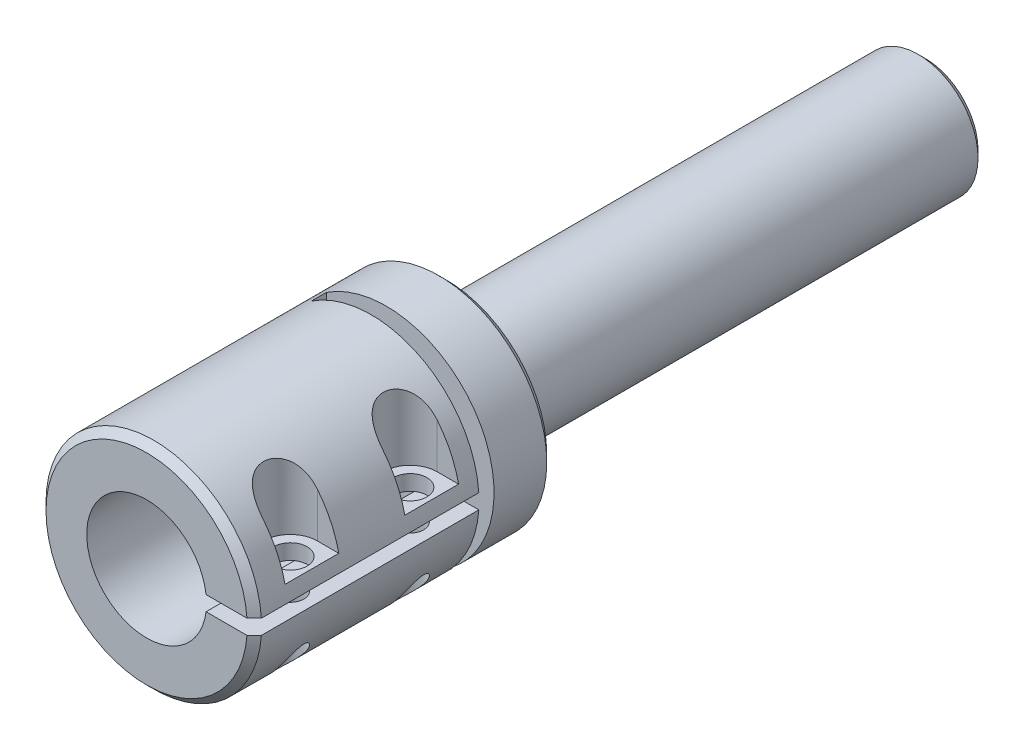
SolidWorks part; units mm, degrees
ref_plane "Front Plane" through (0, 0, 0) normal (0, 0, 1) x (1, 0, 0)
ref_plane "Top Plane" through (0, 0, 0) normal (0, 1, 0) x (1, 0, 0)
ref_plane "Right Plane" through (0, 0, 0) normal (1, 0, 0) x (0, 0, -1)
sketch "Sketch1" plane through (0, 0, 0) normal (0, 0, 1) x (1, 0, 0)
  circle A0 centre (0, 0) radius 11.43
  dimension "D1" = 22.86
extrude "Boss-Extrude1" add sketch "Sketch1" along normal blind 31.75
sketch "Sketch2" plane through (0, 0, 31.75) normal (0, 0, 1) x (1, 0, 0)
  circle A0 centre (0, 0) radius 6.35
  dimension "D1" = 12.7
extrude "Cut-Extrude1" cut sketch "Sketch2" against normal blind 25.4
sketch "Sketch3" plane through (0, 0, 0) normal (0, 0, -1) x (-1, 0, 0)
  circle A0 centre (0, 0) radius 6.35
  dimension "D1" = 12.7
extrude "Boss-Extrude2" add sketch "Sketch3" along normal blind 50.8
chamfer "Chamfer1" distance 0.762 angle 45 1 edges at (-6.35, 0, -50.8)
ref_plane "Plane1" through (0, 2.413, 0) normal (0, 1, 0) x (-1, 0, 0)
sketch "Sketch4" plane through (0, 2.413, 0) normal (0, 1, 0) x (-1, 0, 0)
  line L0 (-11.43, 25.4) -> (-6.35, 25.4) construction
  line L1 (-11.43, 31.75) -> (-11.43, 0) construction
  line L2 (-6.35, 31.75) -> (-6.35, 6.35) construction
  line L3 (-11.43, 12.7) -> (-6.35, 12.7) construction
  line L5 (11.43, 31.75) -> (-11.43, 31.75) construction
  circle A0 centre (-8.89, 25.4) radius 1.778
  circle A1 centre (-8.89, 12.7) radius 1.778
  dimension "D1" = 3.556
  dimension "D2" = 6.35
  dimension "D3" = 12.7
extrude "Cut-Extrude2" cut sketch "Sketch4" against normal blind 3.175
sketch "Sketch5" plane through (0, 0, 31.75) normal (0, 0, 1) x (1, 0, 0)
  line L1 (0, 0.7874) -> (31.0854, 0.7874)
  line L2 (0, 0.7874) -> (0, -0.7874)
  line L3 (0, -0.7874) -> (31.0854, -0.7874)
  line L4 (31.0854, 0.7874) -> (31.0854, -0.7874)
  dimension "D1" = 1.5748
extrude "Cut-Extrude3" cut sketch "Sketch5" against normal up to surface (25.4 mm away)
sketch "Sketch6" plane through (0, 2.413, 0) normal (0, 1, 0) x (-1, 0, 0)
  line L0 (-8.89, 28.25) -> (-11.4028, 28.25)
  line L1 (-11.4028, 31.75) -> (-11.4028, 6.35) construction
  line L2 (-11.4028, 28.25) -> (-11.4028, 22.55)
  line L3 (-11.4028, 22.55) -> (-8.89, 22.55)
  line L4 (-8.89, 15.55) -> (-11.4028, 15.55)
  line L5 (-11.4028, 15.55) -> (-11.4028, 9.85)
  line L6 (-11.4028, 9.85) -> (-8.89, 9.85)
  arc A0 (-8.89, 22.55) -> (-8.89, 28.25) centre (-8.89, 25.4) ccw
  arc A1 (-8.89, 9.85) -> (-8.89, 15.55) centre (-8.89, 12.7) ccw
  dimension "D1" = 5.7
extrude "Cut-Extrude4" cut sketch "Sketch6" along normal through all
ref_plane "Plane2" through (-6.35, 0, 0) normal (1, 0, 0) x (0, 0, -1)
sketch "Sketch7" plane through (-6.35, 0, 0) normal (1, 0, 0) x (0, 0, -1)
  line L0 (-6.35, 0.7874) -> (-6.35, -0.7874) construction
  line L1 (-7.9375, 26.5989) -> (-6.35, 26.5989)
  line L2 (-7.9375, 26.5989) -> (-7.9375, -24.7744)
  line L3 (-7.9375, -24.7744) -> (-6.35, -24.7744)
  line L4 (-6.35, 26.5989) -> (-6.35, -24.7744)
  dimension "D1" = 1.5875
extrude "Cut-Extrude5" cut sketch "Sketch7" along normal through all
sketch "Sketch8" plane through (0, 0, 0) normal (0, 0, -1) x (-1, 0, 0)
  circle A0 centre (0, 0) radius 6.35
  circle A1 centre (0, 0) radius 6.0325
  circle A2 centre (0, 0) radius 6.35 construction
  dimension "D1" = 12.065
extrude "Cut-Extrude6" cut sketch "Sketch8" along normal blind 0.381
chamfer "Chamfer2" distance 0.762 angle 45 2 edges at (-11.43, 0, 31.75) (11.43, 0, 0)
hole_wizard "#6-40 Tapped Hole1" positions "Sketch10" profile "Sketch9" tap size "#6-40" standard "ANSI Inch"
sketch "Sketch10" plane through (0, -0.7874, 0) normal (0, 1, 0) x (1, 0, 0)
  circle A1 centre (8.89, -25.4) radius 1.778 construction
  point P0 (8.89, -12.7)
  point P3 (8.89, -25.4)
sketch "Sketch9" plane through (8.89, -0.7874, 12.7) normal (1, 0, 0) x (0, 0, 1)
  line L0 (0, 0) -> (0, 11.2763)
  line L1 (0, 11.2763) -> (1.4351, 10.414)
  line L2 (1.4351, 10.414) -> (1.4351, 0)
  line L5 (1.4351, 0) -> (0, 0)
  line L10 (0, 11.2763) -> (-1.4351, 10.414) construction
  line L11 (0, -6.35) -> (0, 107.95) construction
  dimension "Tap Drill Dia." = 2.8702
  dimension "Tap Drill Depth" = 10.414
  dimension "Drill Angle" = 118
